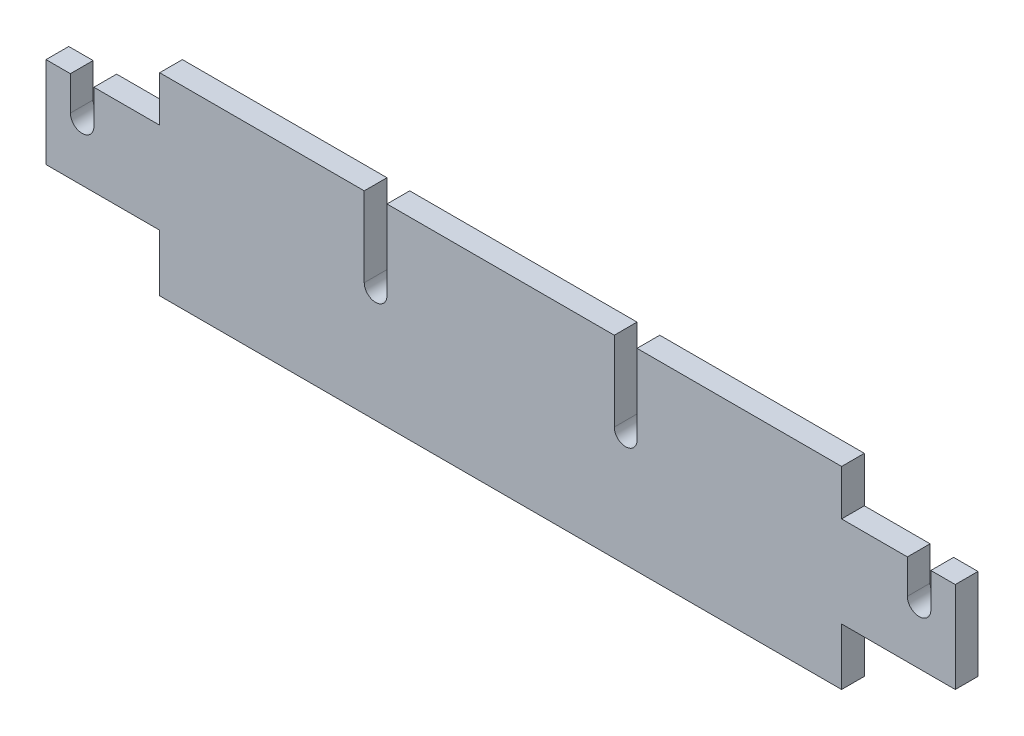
SolidWorks part; units mm, degrees
ref_plane "Plano frontal" through (0, 0, 0) normal (0, 0, 1) x (1, 0, 0)
ref_plane "Plano superior" through (0, 0, 0) normal (0, 1, 0) x (1, 0, 0)
ref_plane "Plano direito" through (0, 0, 0) normal (1, 0, 0) x (0, 0, -1)
sketch "Esboço1" plane through (0, 0, 0) normal (0, 0, 1) x (1, 0, 0)
  line L0 (0, 0) -> (0, 17) construction
  line L1 (-30, 0) -> (30, 0)
  line L2 (30, 0) -> (30, 5)
  line L3 (30, 5) -> (40, 5)
  line L4 (40, 5) -> (40, 13)
  line L5 (40, 13) -> (30, 13)
  line L6 (30, 13) -> (30, 17)
  line L7 (30, 17) -> (12, 17)
  line L8 (11, 17) -> (11, 10) construction
  line L9 (12, 17) -> (12, 10)
  line L10 (10, 17) -> (10, 10)
  line L11 (10, 17) -> (-10, 17)
  line L12 (36.8202, 13) -> (36.8202, 10) construction
  line L13 (37.8537, 13) -> (37.8537, 10)
  line L14 (35.7868, 13) -> (35.7868, 10)
  line L15 (-11, 17) -> (-11, 10) construction
  line L16 (-10, 17) -> (-10, 10)
  line L17 (-12, 17) -> (-12, 10)
  line L18 (-30, 17) -> (-12, 17)
  line L19 (-30, 13) -> (-30, 17)
  line L20 (-40, 13) -> (-30, 13)
  line L21 (-40, 5) -> (-40, 13)
  line L22 (-30, 5) -> (-40, 5)
  line L23 (-30, 0) -> (-30, 5)
  line L24 (-36.8202, 13) -> (-36.8202, 10) construction
  line L25 (-37.8537, 13) -> (-37.8537, 10)
  line L26 (-35.7868, 13) -> (-35.7868, 10)
  arc A0 (37.8537, 13) -> (35.7868, 13) centre (36.8202, 13) ccw
  arc A1 (10, 10) -> (12, 10) centre (11, 10) ccw
  arc A2 (35.7868, 10) -> (37.8537, 10) centre (36.8202, 10) ccw
  arc A3 (-10, 10) -> (-12, 10) centre (-11, 10) cw
  arc A4 (-37.8537, 13) -> (-35.7868, 13) centre (-36.8202, 13) cw
  arc A5 (-35.7868, 10) -> (-37.8537, 10) centre (-36.8202, 10) cw
  point P11 (11, 13.5)
  point P18 (36.8202, 11.5)
  point P37 (-36.8202, 11.5)
  point P42 (-11, 13.5)
  dimension "D1" = 60
  dimension "D2" = 80
  dimension "D3" = 17
  dimension "D4" = 8
  dimension "D5" = 5
  dimension "D6" = 2
  dimension "D7" = 10
  dimension "D8" = 8
extrude "Ressalto-extrusão1" add sketch "Esboço1" along normal blind 2 contours L26 A5 L25 L20 L21 L22 L23 L1 L2 L3 L4 L5 L13 A2 L14 L6 L7 L9 A1 L10 L11 L16 A3 L17 L18 L19
